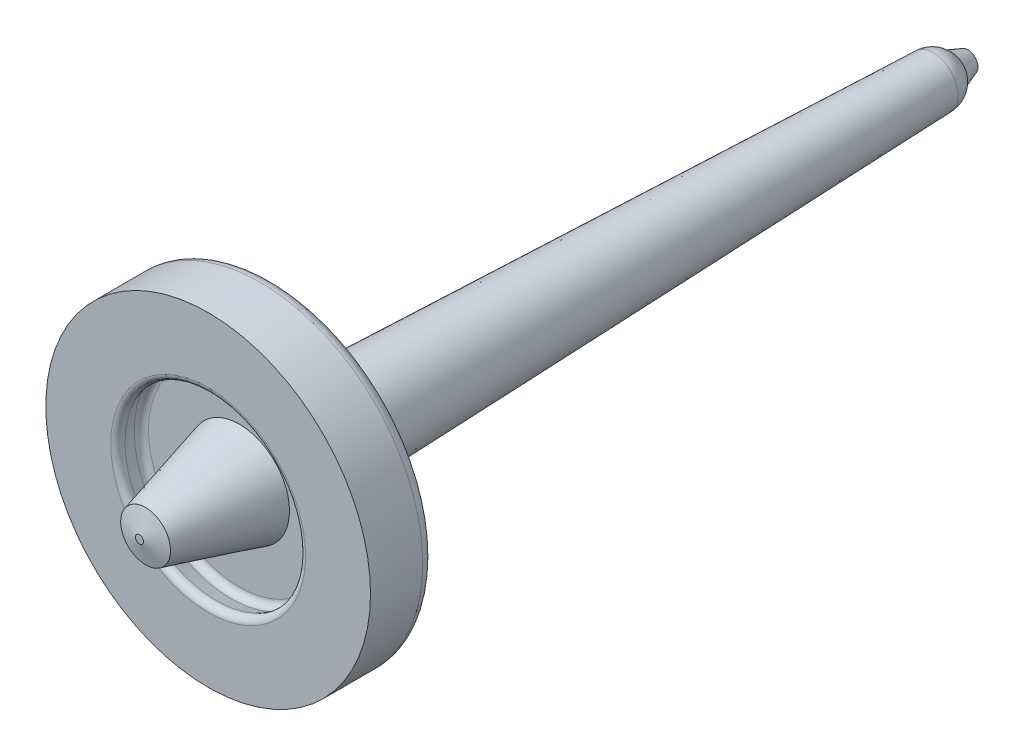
SolidWorks part; units mm, degrees
ref_plane "Plan de face" through (0, 0, 0) normal (0, 0, 1) x (1, 0, 0)
ref_plane "Plan de dessus" through (0, 0, 0) normal (0, 1, 0) x (1, 0, 0)
ref_plane "Plan de droite" through (0, 0, 0) normal (1, 0, 0) x (0, 0, -1)
imported_body "Importée1"
sketch "Esquisse1" plane through (0, 0, -136.6666) normal (0, 0, 1) x (1, 0, 0)
  circle A0 centre (0, 0) radius 4.01
  dimension "D1" = 8.02
extrude "Extrusion1" add sketch "Esquisse1" along normal blind 8 draft 15
sketch "Esquisse2" plane through (0, 0, 0) normal (1, 0, 0) x (0, 0, -1)
  line L0 (131.0821, 0.0244) -> (124.5668, 0.0244) construction
  line L1 (129.1666, -2.0126) -> (128.5723, 0.0244)
  line L2 (129.1666, -2.0126) -> (127.4722, -2.0126)
  line L3 (127.4722, -2.0126) -> (127.4722, 0.0244)
  line L4 (127.4722, 0.0244) -> (128.5723, 0.0244)
  line L5 (128.6666, 1.8664) -> (128.6666, -1.8664) construction
  dimension "D1" = 0.5
revolve "Enlèvement de matière-Révolution1" cut sketch "Esquisse2" angle 360 about L4
